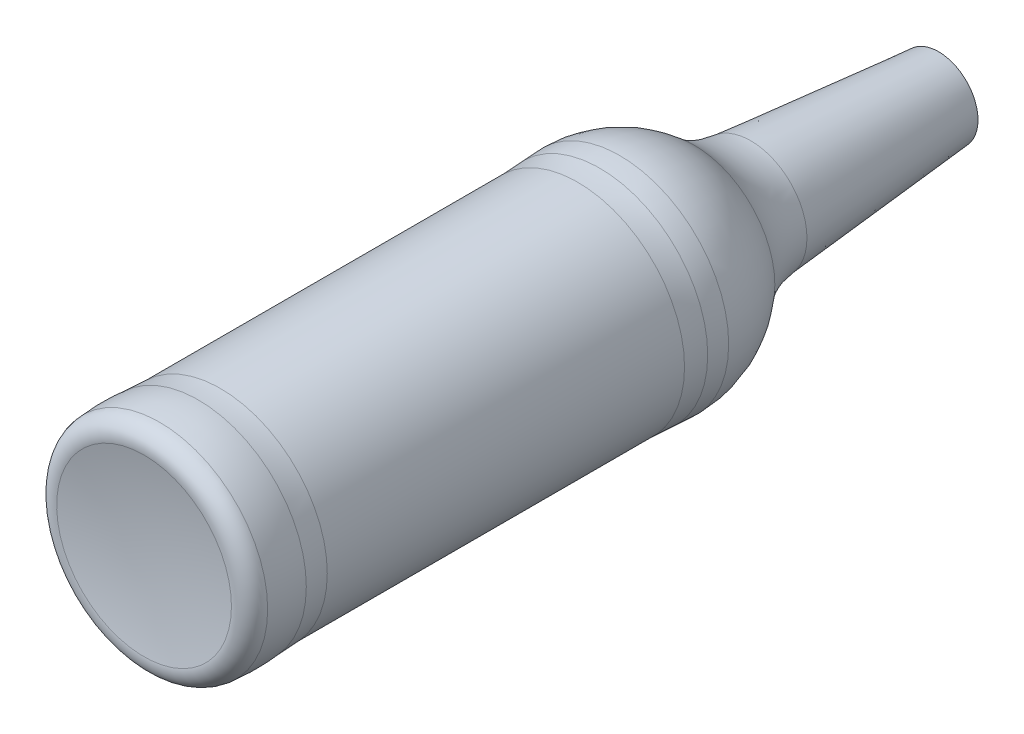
SolidWorks part; units mm, degrees
ref_plane "Ebene vorne" through (0, 0, 0) normal (0, 0, 1) x (1, 0, 0)
ref_plane "Ebene oben" through (0, 0, 0) normal (0, 1, 0) x (1, 0, 0)
ref_plane "Ebene rechts" through (0, 0, 0) normal (1, 0, 0) x (0, 0, -1)
sketch "Skizze1" plane through (0, 0, 0) normal (0, 0, 1) x (1, 0, 0)
  circle A0 centre (0, 0) radius 35
  dimension "D1" = 70
extrude "Aufsatz-Linear austragen1" add sketch "Skizze1" along normal blind 270
other "Formnest1"
other "LongneckFlasche_AK<1>@Flasche gefüllt1"
sketch "Skizze2" plane through (0, 0, 0) normal (1, 0, 0) x (0, 0, -1)
  line L1 (-39, -11.2775) -> (0, -11.2775)
  line L2 (-39, -11.2775) -> (-39, 11.2775)
  line L3 (-39, 11.2775) -> (0, 11.2775)
  line L4 (0, -11.2775) -> (0, 11.2775)
  line L6 (-18.5651, 9.4647) -> (-92.5869, 16.0314) construction
  line L7 (-92.5869, -16.0314) -> (-18.5651, -9.4647) construction
  dimension "D1" = 39
extrude "Schnitt-Linear austragen1" cut sketch "Skizze2" against normal through all and the other way through all
